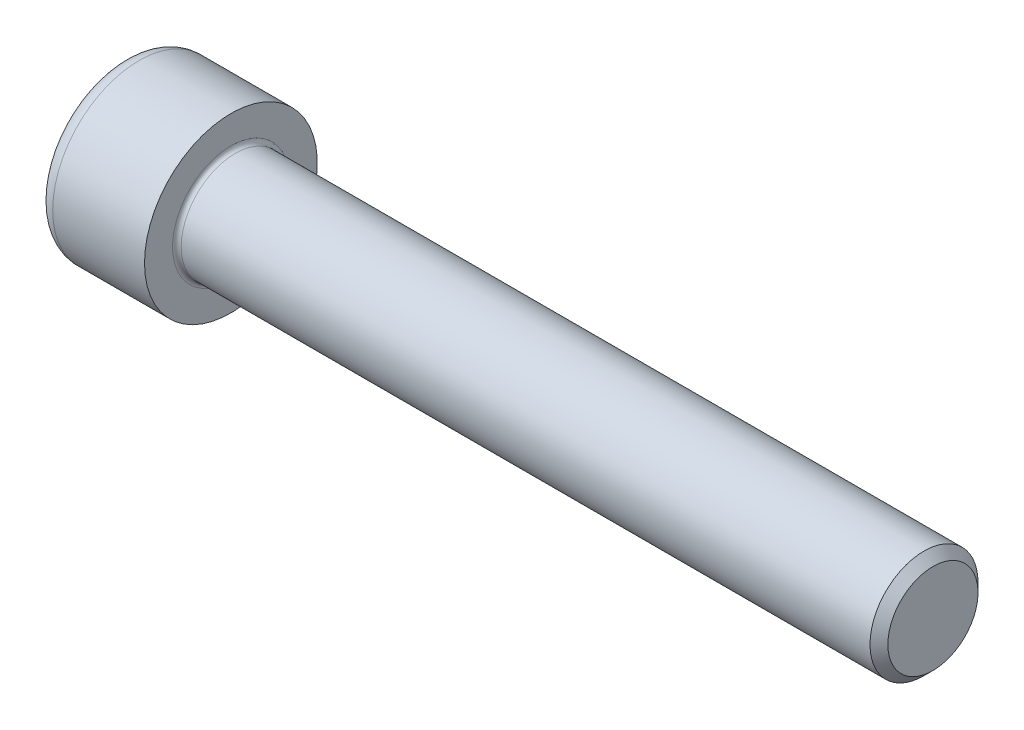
SolidWorks part; units mm, degrees
revolve "Base-Revolve" add sketch "BodySke"
sketch "BodySke" plane through (0, 0, 0) normal (0, 0, 1) x (1, 0, 0)
  line L0 (0, 0) -> (0, 8)
  line L1 (0, 8) -> (10, 8)
  line L2 (10, 8) -> (10, 5)
  line L3 (10, 5) -> (74.172, 5)
  line L4 (75, 4.172) -> (75, 0)
  line L5 (75, 0) -> (0, 0)
  line L6 (-31.75, 0) -> (127, 0) construction
  line L8 (75, 4.172) -> (74.172, 5)
  line L10 (75, -4.172) -> (74.172, -5) construction
  line L11 (11.5, 9.525) -> (11.5, 3.175) construction
  line L12 (43, 9.525) -> (43, 3.175) construction
  line L13 (15, 9.525) -> (15, 3.175) construction
fillet "Fillet1" radius 0.4 1 edges at (10, 0, 5)
fillet "Fillet2" radius 1.5 1 edges at (0, 0, 8)
ref_plane "Plane1" through (0, 0, 0) normal (0, 0, 1) x (1, 0, 0)
ref_plane "Plane2" through (0, 0, 0) normal (0, 1, 0) x (1, 0, 0)
ref_plane "Plane3" through (0, 0, 0) normal (1, 0, 0) x (0, 0, -1)
sketch "Sketch2" plane through (0, 0, 0) normal (0, 0, 1) x (1, 0, 0)
  line L0 (0, 4.0575) -> (5, 4.0575)
  line L1 (5, 4.0575) -> (7.3426, 0)
  line L2 (-31.75, 0) -> (127, 0) construction
  line L3 (7.3426, 0) -> (0, 0)
  line L4 (0, 0) -> (0, 4.0575)
  line L6 (0, 0) -> (47.625, 0) construction
revolve "Hex-PreBroach" cut sketch "Sketch2" angle 360 about L6
sketch "Sketch3" plane through (0, 0, 0) normal (-1, 0, 0) x (0, 0.5, 0.866)
  line L0 (2.3426, 4.0575) -> (-2.3426, 4.0575)
  line L1 (-2.3426, 4.0575) -> (-4.6852, 0)
  line L2 (2.3426, 4.0575) -> (4.6852, 0)
  line L3 (2.3426, -4.0575) -> (4.6852, 0)
  line L4 (2.3426, -4.0575) -> (-2.3426, -4.0575)
  line L5 (-2.3426, -4.0575) -> (-4.6852, 0)
extrude "Hex" cut sketch "Sketch3" against normal blind 5
sketch "ThdSchSke" plane through (0, 0, 0) normal (0, 0, 1) x (1, 0, 0)
  line L0 (43, -4.172) -> (42.4202, -5)
  line L1 (43, -4.172) -> (43.5798, -5)
  line L2 (43.5798, -5) -> (43.5798, -6.25)
  line L3 (-3.175, 0) -> (5.1513, 0) construction
  line L4 (0, 6.5) -> (0, -6.5) construction
  line L5 (43.5798, -6.25) -> (42.4202, -6.25)
  line L6 (42.4202, -6.25) -> (42.4202, -5)
revolve "ThreadSchematic" [suppressed] cut sketch "ThdSchSke" angle 360 about L3
pattern_linear "ThdSchPat" [suppressed]
equation "\"D2@Sketch3\" = \"Hex_size@Sketch3\" / 2"
equation "\"D1@Sketch3\" = \"Hex_size@Sketch3\" / 2"
equation "\"D1@Sketch2\" = \"Hex_size@Sketch3\" / 2"
equation "\"Thread_minor@ThreadCosmetic\"  =  \"Minor_dia@BodySke\""
equation "\"Depth@Sketch2\" =  \"Key_eng@Hex\""
equation "\"Thread_length@ThreadCosmetic\" = ((sgn( (\"Length@BodySke\" - \"Advance@BodySke\" * 3.0) - \"Thread_nom@BodySke\" )-1)*( (\"Length@BodySke\" - \"Advance@BodySke\" * 3.0) - \"Thread_nom@BodySke\" ))/-2+ \"Thread_no"
equation "\"Thread_minor@ThdSchSke\" = \"Minor_dia@BodySke\""
equation "\"Diameter@ThdSchSke\" = \"Diameter@BodySke\""
equation "\"Overcut@ThdSchSke\" = \"Diameter@BodySke\" * 1.25"
equation "\"Start@ThdSchSke\" = \"Head_ht@BodySke\" + \"Length@BodySke\" - \"Thread_length@ThreadCosmetic\"  '---Non-countersunk---"
equation "\"Num_threads@ThdSchPat\" = int( \"Thread_length@ThreadCosmetic\" / \"Advance@BodySke\" + 0.999 )  + 1"
equation "\"Advance@ThdSchPat\" = \"Thread_length@ThreadCosmetic\" /  (\"Num_threads@ThdSchPat\" - 1) 'relax it"
equation "\"Num_threads@ThdSchPat\" = \"Num_threads@ThdSchPat\" - sgn( \"Num_threads@ThdSchPat\" - 1) '---chamfered tips only---"
